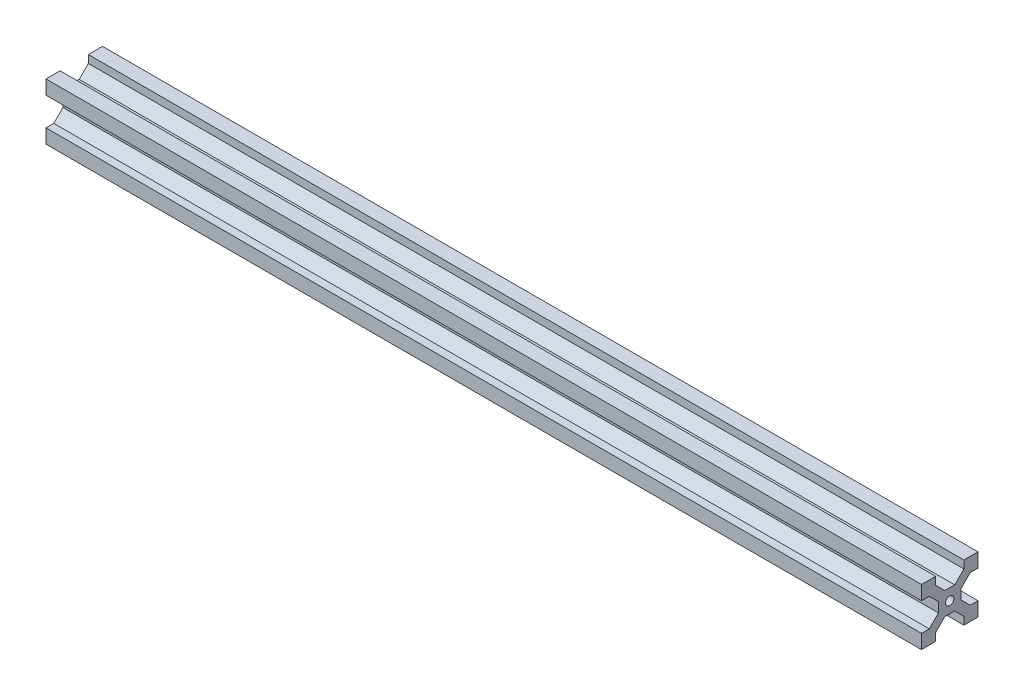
SolidWorks part; units mm, degrees
ref_plane "Alzado" through (0, 0, 0) normal (0, 0, 1) x (1, 0, 0)
ref_plane "Planta" through (0, 0, 0) normal (0, 1, 0) x (1, 0, 0)
ref_plane "Vista lateral" through (0, 0, 0) normal (1, 0, 0) x (0, 0, -1)
sketch "Croquis1" plane through (0, 0, 0) normal (1, 0, 0) x (0, 0, -1)
  line L0 (-5, 10) -> (-5, 7.25)
  line L1 (-10, 10) -> (10, 10) construction
  line L2 (-10, 10) -> (-10, -10) construction
  line L3 (-10, -10) -> (10, -10) construction
  line L4 (10, 10) -> (10, -10) construction
  line L5 (0, 0) -> (0, 10.1964) construction
  line L6 (0, 0) -> (-10, 0) construction
  line L7 (-5, 7.25) -> (-1.75, 4)
  line L8 (-1.75, 4) -> (0, 4)
  line L9 (-4, -1.75) -> (-4, 1.75)
  line L10 (-4, 1.75) -> (-7.25, 5)
  line L11 (-10, 5) -> (-7.25, 5)
  line L12 (-1.75, -4) -> (1.75, -4)
  line L13 (-5, -10) -> (-5, -7.25)
  line L14 (-5, -7.25) -> (-1.75, -4)
  line L15 (-4, -1.75) -> (-7.25, -5)
  line L16 (-10, -5) -> (-7.25, -5)
  line L17 (5, 7.25) -> (1.75, 4)
  line L18 (5, 10) -> (5, 7.25)
  line L19 (10, 5) -> (7.25, 5)
  line L20 (4, 1.75) -> (7.25, 5)
  line L21 (4, -1.75) -> (4, 1.75)
  line L22 (10, -5) -> (7.25, -5)
  line L23 (4, -1.75) -> (7.25, -5)
  line L24 (5, -7.25) -> (1.75, -4)
  line L25 (5, -10) -> (5, -7.25)
  line L26 (-10, 5) -> (-10, 10)
  line L27 (-10, 10) -> (-5, 10)
  line L28 (-10, -5) -> (-10, -10)
  line L29 (-10, -10) -> (-5, -10)
  line L30 (5, -10) -> (10, -10)
  line L31 (10, -10) -> (10, -5)
  line L32 (10, 5) -> (10, 10)
  line L33 (10, 10) -> (5, 10)
  line L34 (1.75, 4) -> (0, 4)
  circle A0 centre (0, 0) radius 1.5
  point P17 (-5.625, 3.375)
  point P23 (-4, 0)
  point P32 (0, -4)
  dimension "D12" = 3
  dimension "D1" = 10
  dimension "D2" = 10
  dimension "D3" = 20
  dimension "D4" = 20
  dimension "D5" = 1.75
  dimension "D6" = 1.75
  dimension "D7" = 5
  dimension "D8" = 2.75
  dimension "5" = 5
  dimension "D9" = 4
  dimension "D10" = 4
  dimension "D11" = 2.75
extrude "Saliente-Extruir1" add sketch "Croquis1" along normal mid plane 310
